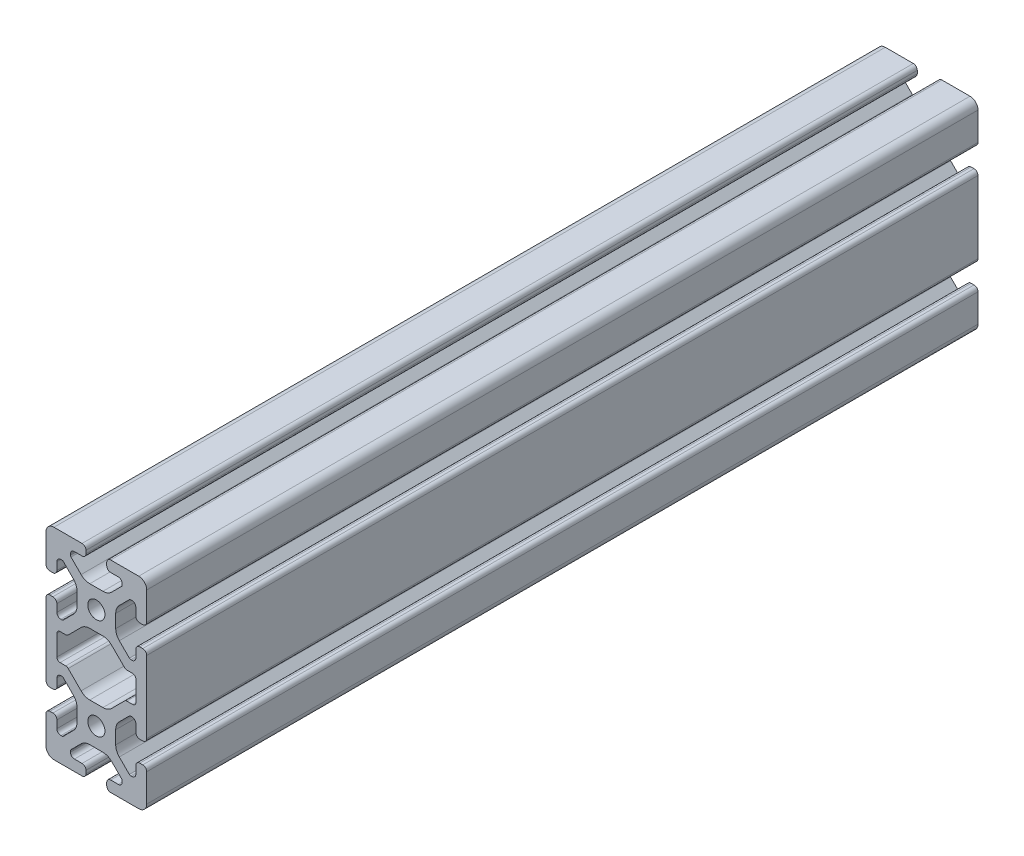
SolidWorks part; units mm, degrees
ref_plane "Front Plane" through (0, 0, 0) normal (0, 0, 1) x (1, 0, 0)
ref_plane "Top Plane" through (0, 0, 0) normal (0, 1, 0) x (1, 0, 0)
ref_plane "Right Plane" through (0, 0, 0) normal (1, 0, 0) x (0, 0, -1)
ref_plane "Plane1" through (0, 0, -3048) normal (0, 0, -1) x (-1, 0, 0)
sketch "Sketch1" plane through (0, 0, -3048) normal (0, 0, -1) x (-1, 0, 0)
  line L0 (14.41, 14.6586) -> (12.13, 14.6586)
  line L1 (11.1794, 14.2308) -> (6.0551, 9.1098)
  line L2 (2.6153, 7.685) -> (-2.6153, 7.685)
  line L3 (-6.0551, 9.1098) -> (-11.232, 14.2867)
  line L4 (-12.13, 14.6586) -> (-14.41, 14.6586)
  line L5 (-15.68, 15.9286) -> (-15.68, 24.0714)
  line L6 (-14.41, 25.3414) -> (-12.13, 25.3414)
  line L7 (-11.232, 25.7133) -> (-6.0551, 30.8902)
  line L8 (-2.6153, 32.315) -> (2.6176, 32.315)
  line L9 (6.0573, 30.8902) -> (11.1842, 25.7634)
  line L10 (12.13, 25.3414) -> (14.41, 25.3414)
  line L11 (15.68, 24.0714) -> (15.68, 15.9286)
  line L12 (16.83, 60) -> (5.6904, 60)
  line L13 (4.1204, 58.43) -> (4.1204, 57.25)
  line L14 (5.6904, 55.68) -> (8.7154, 55.68)
  line L15 (10.2854, 54.11) -> (10.2854, 53.6549)
  line L16 (10.0628, 53.1175) -> (6.0551, 49.1098)
  line L17 (2.6153, 47.685) -> (-2.6153, 47.685)
  line L18 (-6.0551, 49.1098) -> (-10.0628, 53.1175)
  line L19 (-10.2854, 53.6549) -> (-10.2854, 54.11)
  line L20 (-8.7154, 55.68) -> (-5.6904, 55.68)
  line L21 (-4.1204, 57.25) -> (-4.1204, 58.43)
  line L22 (-5.6904, 60) -> (-16.83, 60)
  line L23 (-20, 56.83) -> (-20, 45.6904)
  line L24 (-18.43, 44.1204) -> (-17.25, 44.1204)
  line L25 (-15.68, 45.6904) -> (-15.68, 48.7154)
  line L26 (-14.11, 50.2854) -> (-13.6527, 50.2854)
  line L27 (-13.1153, 50.0628) -> (-9.1098, 46.0573)
  line L28 (-7.685, 42.6176) -> (-7.685, 37.3847)
  line L29 (-9.1098, 33.9449) -> (-13.1175, 29.9372)
  line L30 (-13.6549, 29.7146) -> (-14.11, 29.7146)
  line L31 (-15.68, 31.2846) -> (-15.68, 34.3096)
  line L32 (-17.25, 35.8796) -> (-18.43, 35.8796)
  line L33 (-20, 34.3096) -> (-20, 5.6904)
  line L34 (-18.43, 4.1204) -> (-17.25, 4.1204)
  line L35 (-15.68, 5.6904) -> (-15.68, 8.7154)
  line L36 (-14.11, 10.2854) -> (-13.6549, 10.2854)
  line L37 (-13.1175, 10.0628) -> (-9.1098, 6.0551)
  line L38 (-7.685, 2.6153) -> (-7.685, -2.6153)
  line L39 (-9.1098, -6.0551) -> (-13.1175, -10.0628)
  line L40 (-13.6549, -10.2854) -> (-14.11, -10.2854)
  line L41 (-15.68, -8.7154) -> (-15.68, -5.6904)
  line L42 (-17.25, -4.1204) -> (-18.43, -4.1204)
  line L43 (-20, -5.6904) -> (-20, -16.83)
  line L44 (-16.83, -20) -> (-5.6904, -20)
  line L45 (-4.1204, -18.43) -> (-4.1204, -17.25)
  line L46 (-5.6904, -15.68) -> (-8.7154, -15.68)
  line L47 (-10.2854, -14.11) -> (-10.2854, -13.6549)
  line L48 (-10.0628, -13.1175) -> (-6.0551, -9.1098)
  line L49 (-2.6153, -7.685) -> (2.6153, -7.685)
  line L50 (6.0551, -9.1098) -> (10.0628, -13.1175)
  line L51 (10.2854, -13.6549) -> (10.2854, -14.11)
  line L52 (8.7154, -15.68) -> (5.6904, -15.68)
  line L53 (4.1204, -17.25) -> (4.1204, -18.43)
  line L54 (5.6904, -20) -> (16.83, -20)
  line L55 (20, -16.83) -> (20, -5.6904)
  line L56 (18.43, -4.1204) -> (17.25, -4.1204)
  line L57 (15.68, -5.6904) -> (15.68, -8.7154)
  line L58 (14.11, -10.2854) -> (13.6549, -10.2854)
  line L59 (13.1175, -10.0628) -> (9.1098, -6.0551)
  line L60 (7.685, -2.6153) -> (7.685, 2.6153)
  line L61 (9.1098, 6.0551) -> (13.1175, 10.0628)
  line L62 (13.6549, 10.2854) -> (14.11, 10.2854)
  line L63 (15.68, 8.7154) -> (15.68, 5.6904)
  line L64 (17.25, 4.1204) -> (18.43, 4.1204)
  line L65 (20, 5.6904) -> (20, 34.3096)
  line L66 (18.43, 35.8796) -> (17.25, 35.8796)
  line L67 (15.68, 34.3096) -> (15.68, 31.2846)
  line L68 (14.11, 29.7146) -> (13.6549, 29.7146)
  line L69 (13.1175, 29.9372) -> (9.1098, 33.9449)
  line L70 (7.685, 37.3847) -> (7.685, 42.6153)
  line L71 (9.1098, 46.0551) -> (13.1175, 50.0628)
  line L72 (13.6549, 50.2854) -> (14.11, 50.2854)
  line L73 (15.68, 48.7154) -> (15.68, 45.6904)
  line L74 (17.25, 44.1204) -> (18.43, 44.1204)
  line L75 (20, 45.6904) -> (20, 56.83)
  arc A0 (15.68, 15.9286) -> (14.41, 14.6586) centre (14.41, 15.9286) cw
  arc A1 (12.13, 14.6586) -> (11.1794, 14.2308) centre (12.13, 13.3886) ccw
  arc A2 (6.0551, 9.1098) -> (2.6153, 7.685) centre (2.6153, 12.5496) cw
  arc A3 (-2.6153, 7.685) -> (-6.0551, 9.1098) centre (-2.6153, 12.5496) cw
  arc A4 (-11.232, 14.2867) -> (-12.13, 14.6586) centre (-12.13, 13.3886) ccw
  arc A5 (-14.41, 14.6586) -> (-15.68, 15.9286) centre (-14.41, 15.9286) cw
  arc A6 (-15.68, 24.0714) -> (-14.41, 25.3414) centre (-14.41, 24.0714) cw
  arc A7 (-12.13, 25.3414) -> (-11.232, 25.7133) centre (-12.13, 26.6114) ccw
  arc A8 (-6.0551, 30.8902) -> (-2.6153, 32.315) centre (-2.6153, 27.4504) cw
  arc A9 (2.6176, 32.315) -> (6.0573, 30.8902) centre (2.6176, 27.4504) cw
  arc A10 (11.1842, 25.7634) -> (12.13, 25.3414) centre (12.13, 26.6123) ccw
  arc A11 (14.41, 25.3414) -> (15.68, 24.0714) centre (14.41, 24.0714) cw
  circle A12 centre (0, 0) radius 3.405
  circle A13 centre (0, 40) radius 3.405
  arc A14 (5.6904, 60) -> (4.1204, 58.43) centre (5.6904, 58.43) ccw
  arc A15 (4.1204, 57.25) -> (5.6904, 55.68) centre (5.6904, 57.25) ccw
  arc A16 (8.7154, 55.68) -> (10.2854, 54.11) centre (8.7154, 54.11) cw
  arc A17 (10.2854, 53.6549) -> (10.0628, 53.1175) centre (9.5254, 53.6549) cw
  arc A18 (6.0551, 49.1098) -> (2.6153, 47.685) centre (2.6153, 52.5496) cw
  arc A19 (-2.6153, 47.685) -> (-6.0551, 49.1098) centre (-2.6153, 52.5496) cw
  arc A20 (-10.0628, 53.1175) -> (-10.2854, 53.6549) centre (-9.5254, 53.6549) cw
  arc A21 (-10.2854, 54.11) -> (-8.7154, 55.68) centre (-8.7154, 54.11) cw
  arc A22 (-5.6904, 55.68) -> (-4.1204, 57.25) centre (-5.6904, 57.25) ccw
  arc A23 (-4.1204, 58.43) -> (-5.6904, 60) centre (-5.6904, 58.43) ccw
  arc A24 (-16.83, 60) -> (-20, 56.83) centre (-16.83, 56.83) ccw
  arc A25 (-20, 45.6904) -> (-18.43, 44.1204) centre (-18.43, 45.6904) ccw
  arc A26 (-17.25, 44.1204) -> (-15.68, 45.6904) centre (-17.25, 45.6904) ccw
  arc A27 (-15.68, 48.7154) -> (-14.11, 50.2854) centre (-14.11, 48.7154) cw
  arc A28 (-13.6527, 50.2854) -> (-13.1153, 50.0628) centre (-13.6527, 49.5254) cw
  arc A29 (-9.1098, 46.0573) -> (-7.685, 42.6176) centre (-12.5496, 42.6176) cw
  arc A30 (-7.685, 37.3847) -> (-9.1098, 33.9449) centre (-12.5496, 37.3847) cw
  arc A31 (-13.1175, 29.9372) -> (-13.6549, 29.7146) centre (-13.6549, 30.4746) cw
  arc A32 (-14.11, 29.7146) -> (-15.68, 31.2846) centre (-14.11, 31.2846) cw
  arc A33 (-15.68, 34.3096) -> (-17.25, 35.8796) centre (-17.25, 34.3096) ccw
  arc A34 (-18.43, 35.8796) -> (-20, 34.3096) centre (-18.43, 34.3096) ccw
  arc A35 (-20, 5.6904) -> (-18.43, 4.1204) centre (-18.43, 5.6904) ccw
  arc A36 (-17.25, 4.1204) -> (-15.68, 5.6904) centre (-17.25, 5.6904) ccw
  arc A37 (-15.68, 8.7154) -> (-14.11, 10.2854) centre (-14.11, 8.7154) cw
  arc A38 (-13.6549, 10.2854) -> (-13.1175, 10.0628) centre (-13.6549, 9.5254) cw
  arc A39 (-9.1098, 6.0551) -> (-7.685, 2.6153) centre (-12.5496, 2.6153) cw
  arc A40 (-7.685, -2.6153) -> (-9.1098, -6.0551) centre (-12.5496, -2.6153) cw
  arc A41 (-13.1175, -10.0628) -> (-13.6549, -10.2854) centre (-13.6549, -9.5254) cw
  arc A42 (-14.11, -10.2854) -> (-15.68, -8.7154) centre (-14.11, -8.7154) cw
  arc A43 (-15.68, -5.6904) -> (-17.25, -4.1204) centre (-17.25, -5.6904) ccw
  arc A44 (-18.43, -4.1204) -> (-20, -5.6904) centre (-18.43, -5.6904) ccw
  arc A45 (-20, -16.83) -> (-16.83, -20) centre (-16.83, -16.83) ccw
  arc A46 (-5.6904, -20) -> (-4.1204, -18.43) centre (-5.6904, -18.43) ccw
  arc A47 (-4.1204, -17.25) -> (-5.6904, -15.68) centre (-5.6904, -17.25) ccw
  arc A48 (-8.7154, -15.68) -> (-10.2854, -14.11) centre (-8.7154, -14.11) cw
  arc A49 (-10.2854, -13.6549) -> (-10.0628, -13.1175) centre (-9.5254, -13.6549) cw
  arc A50 (-6.0551, -9.1098) -> (-2.6153, -7.685) centre (-2.6153, -12.5496) cw
  arc A51 (2.6153, -7.685) -> (6.0551, -9.1098) centre (2.6153, -12.5496) cw
  arc A52 (10.0628, -13.1175) -> (10.2854, -13.6549) centre (9.5254, -13.6549) cw
  arc A53 (10.2854, -14.11) -> (8.7154, -15.68) centre (8.7154, -14.11) cw
  arc A54 (5.6904, -15.68) -> (4.1204, -17.25) centre (5.6904, -17.25) ccw
  arc A55 (4.1204, -18.43) -> (5.6904, -20) centre (5.6904, -18.43) ccw
  arc A56 (16.83, -20) -> (20, -16.83) centre (16.83, -16.83) ccw
  arc A57 (20, -5.6904) -> (18.43, -4.1204) centre (18.43, -5.6904) ccw
  arc A58 (17.25, -4.1204) -> (15.68, -5.6904) centre (17.25, -5.6904) ccw
  arc A59 (15.68, -8.7154) -> (14.11, -10.2854) centre (14.11, -8.7154) cw
  arc A60 (13.6549, -10.2854) -> (13.1175, -10.0628) centre (13.6549, -9.5254) cw
  arc A61 (9.1098, -6.0551) -> (7.685, -2.6153) centre (12.5496, -2.6153) cw
  arc A62 (7.685, 2.6153) -> (9.1098, 6.0551) centre (12.5496, 2.6153) cw
  arc A63 (13.1175, 10.0628) -> (13.6549, 10.2854) centre (13.6549, 9.5254) cw
  arc A64 (14.11, 10.2854) -> (15.68, 8.7154) centre (14.11, 8.7154) cw
  arc A65 (15.68, 5.6904) -> (17.25, 4.1204) centre (17.25, 5.6904) ccw
  arc A66 (18.43, 4.1204) -> (20, 5.6904) centre (18.43, 5.6904) ccw
  arc A67 (20, 34.3096) -> (18.43, 35.8796) centre (18.43, 34.3096) ccw
  arc A68 (17.25, 35.8796) -> (15.68, 34.3096) centre (17.25, 34.3096) ccw
  arc A69 (15.68, 31.2846) -> (14.11, 29.7146) centre (14.11, 31.2846) cw
  arc A70 (13.6549, 29.7146) -> (13.1175, 29.9372) centre (13.6549, 30.4746) cw
  arc A71 (9.1098, 33.9449) -> (7.685, 37.3847) centre (12.5496, 37.3847) cw
  arc A72 (7.685, 42.6153) -> (9.1098, 46.0551) centre (12.5496, 42.6153) cw
  arc A73 (13.1175, 50.0628) -> (13.6549, 50.2854) centre (13.6549, 49.5254) cw
  arc A74 (14.11, 50.2854) -> (15.68, 48.7154) centre (14.11, 48.7154) cw
  arc A75 (15.68, 45.6904) -> (17.25, 44.1204) centre (17.25, 45.6904) ccw
  arc A76 (18.43, 44.1204) -> (20, 45.6904) centre (18.43, 45.6904) ccw
  arc A77 (20, 56.83) -> (16.83, 60) centre (16.83, 56.83) ccw
extrude "Boss-Extrude1" add sketch "Sketch1" against normal blind 3048
ref_plane "Plane2" through (0, 0, -914.4) normal (0, 0, 1) x (1, 0, 0)
ref_plane "Plane3" through (0, 0, -1828.8) normal (0, 0, 1) x (1, 0, 0)
ref_plane "Plane4" through (0, 0, -2159) normal (0, 0, 1) x (1, 0, 0)
ref_plane "Plane5" through (0, 0, -2463.8) normal (0, 0, 1) x (1, 0, 0)
sketch "Sketch26" plane through (0, 0, -914.4) normal (0, 0, 1) x (1, 0, 0)
  line L0 (-20, -20.8001) -> (20, -20.8001)
  line L1 (-20, -20.8001) -> (-20, 60)
  line L2 (-20, 60) -> (20, 60)
  line L3 (20, -20.8001) -> (20, 60)
sketch "Sketch33" plane through (0, 0, -1828.8) normal (0, 0, 1) x (1, 0, 0)
  line L0 (-20, -20.8001) -> (20, -20.8001)
  line L1 (-20, -20.8001) -> (-20, 60)
  line L2 (-20, 60) -> (20, 60)
  line L3 (20, -20.8001) -> (20, 60)
sketch "Sketch41" plane through (0, 0, -2159) normal (0, 0, 1) x (1, 0, 0)
  line L0 (-20, -20.8001) -> (20, -20.8001)
  line L1 (-20, -20.8001) -> (-20, 60)
  line L2 (-20, 60) -> (20, 60)
  line L3 (20, -20.8001) -> (20, 60)
sketch "Sketch50" plane through (0, 0, -2463.8) normal (0, 0, 1) x (1, 0, 0)
  line L0 (-20, -20.8001) -> (20, -20.8001)
  line L1 (-20, -20.8001) -> (-20, 60)
  line L2 (-20, 60) -> (20, 60)
  line L3 (20, -20.8001) -> (20, 60)
extrude "Cut 1 - 3ft" cut sketch "Sketch26" along normal through all
extrude "Cut 2 - 3ft" cut sketch "Sketch33" along normal through all
extrude "Cut 3 - 1ft + 1in" cut sketch "Sketch41" against normal through all
